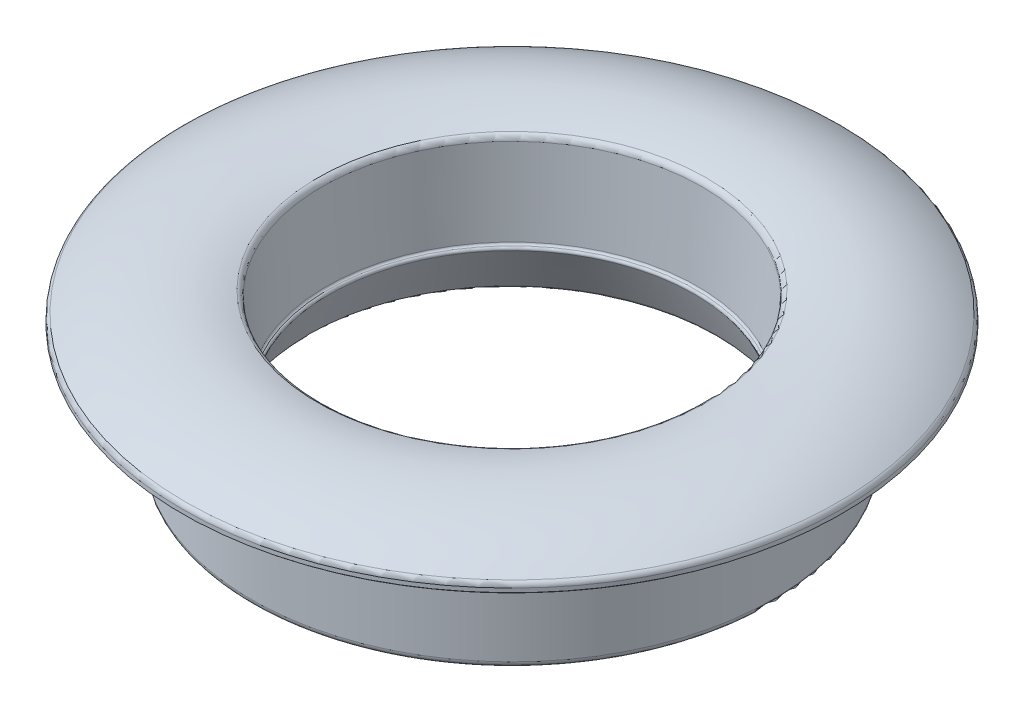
SolidWorks part; units mm, degrees
ref_plane "Front Plane" through (0, 0, 0) normal (0, 0, 1) x (1, 0, 0)
ref_plane "Top Plane" through (0, 0, 0) normal (0, 1, 0) x (1, 0, 0)
ref_plane "Right Plane" through (0, 0, 0) normal (1, 0, 0) x (0, 0, -1)
sketch "Sketch1" plane through (0, 0, 0) normal (0, 0, 1) x (1, 0, 0)
  line L0 (0, 0) -> (0, 51.7671) construction
  line L1 (40.005, 0) -> (40.005, -19.05)
  line L2 (40.005, -19.05) -> (38.1, -19.05)
  line L3 (38.1, -19.05) -> (43.18, -29.972)
  line L4 (43.18, -29.972) -> (54.7449, -29.972)
  line L5 (54.7449, -29.972) -> (54.7449, -6.096)
  line L6 (54.7449, -6.096) -> (49.0844, -6.096)
  line L11 (41.7145, -5.08) -> (54.9303, -5.08) construction
  line L12 (69.2609, -4.318) -> (69.2609, -5.842)
  line L13 (49.0844, -4.064) -> (33.2593, -4.064) construction
  line L14 (36.9308, 1.524) -> (80.7181, 1.524) construction
  arc A0 (40.005, 0) -> (69.2609, -4.318) centre (50.1148, -32.771) cw
  arc A1 (49.0844, -4.064) -> (49.0844, -6.096) centre (48.3224, -5.08) ccw
  arc A2 (69.2609, -5.842) -> (64.1809, -5.842) centre (66.7209, -3.0022) cw
  arc A3 (49.0844, -4.064) -> (64.1809, -5.842) centre (49.0844, -69.0436) cw
  point P23 (48.3224, -5.08)
  dimension "D1" = 80.01
  dimension "D5" = 1.27
  dimension "D2" = 2.032
  dimension "D10" = 6.604
  dimension "D14" = 3.81
  dimension "D15" = 1.524
  dimension "D3" = 5.08
  dimension "D4" = 109.4898
  dimension "D6" = 76.2
  dimension "D7" = 86.36
  dimension "D8" = 96.6448
  dimension "D9" = 5.08
  dimension "D11" = 138.5219
  dimension "D12" = 29.972
  dimension "D13" = 19.05
  dimension "D16" = 0.254
revolve "Revolve1" add sketch "Sketch1" angle 360 about L0
draft "Draft1" type of draft neutral plane draft angle 3 neutral plane "Top Plane" faces to draft 1 parameters "D1"=3
fillet "Fillet1" radius 0.508 1 edges at (0, -19.05, 39.0066)
fillet "Fillet6" radius 0.508 1 edges at (0, -19.05, -38.1)
fillet "Fillet2" radius 1.27 2 edges at (0, -29.972, -54.7449) (0, -29.972, -43.18)
fillet "Fillet3" radius 1.27 1 edges at (0, 0, -40.005)
fillet "Fillet4" radius 1.27 1 edges at (0, -4.318, -69.2609)
fillet "Fillet5" radius 1.27 1 edges at (0, -6.096, -54.7449)
sketch "Sketch2" plane through (0, 0, 0) normal (0, 0, 1) x (1, 0, 0)
  line L0 (54.7449, -14.7934) -> (47.3457, -5.8918)
  line L2 (54.7449, -14.7934) -> (54.7449, -5.588)
  line L3 (54.7449, -5.588) -> (49.4864, -5.588)
  line L5 (54.7449, -28.702) -> (54.7449, -7.366) construction
  line L6 (53.4749, -6.096) -> (-53.4749, -6.096) construction
  line L7 (0, 0) -> (0, -68.3574) construction
  arc A0 (48.3224, -3.81) -> (48.3224, -6.35) centre (48.3224, -5.08) ccw construction
  arc A1 (49.4864, -5.588) -> (47.3457, -5.8918) centre (48.3224, -5.08) ccw
  dimension "D1" = 14.7934
  dimension "D2" = 0.508
revolve "Cut-Revolve1" cut sketch "Sketch2" angle 10 about L7
fillet "Fillet7" radius 1.27 2 edges at (50.2698, -10.3426, 8.8639) (51.0453, -10.3426, 0)
pattern_circular "CirPattern1" count 8 over 360 about axis through (0, 0, 0) along (0, 1, 0) of "Cut-Revolve1", "Fillet7"
